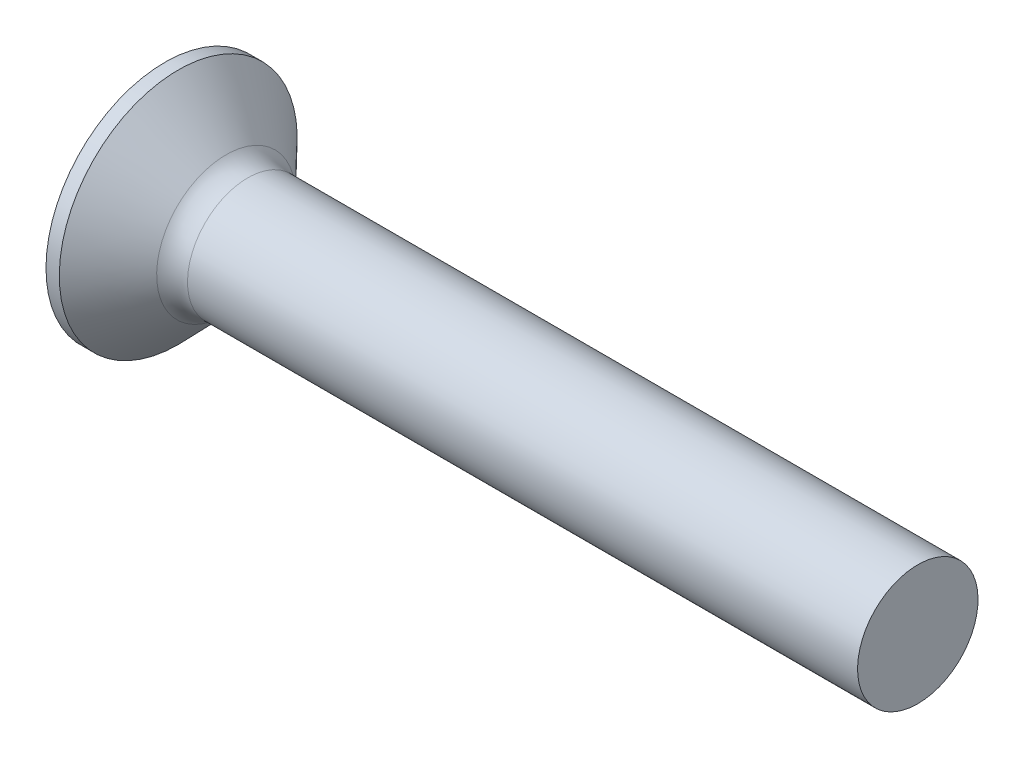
SolidWorks part; units mm, degrees
ref_plane "Front Plane" through (0, 0, 0) normal (0, 0, 1) x (1, 0, 0)
ref_plane "Top Plane" through (0, 0, 0) normal (0, 1, 0) x (1, 0, 0)
ref_plane "Right Plane" through (0, 0, 0) normal (1, 0, 0) x (0, 0, -1)
sketch "BodySke" plane through (0, 0, 0) normal (0, 0, 1) x (1, 0, 0)
  line L0 (2.0141, 0) -> (111.3824, 0) construction
  line L1 (2.0141, 0) -> (2.0141, 7.9) construction
  line L2 (2.0141, 7.9) -> (2.898, 7.9)
  line L3 (2.898, 7.9) -> (6.6641, 4)
  line L4 (6.6641, 4) -> (52.0141, 4)
  line L5 (52.0141, 4) -> (52.0141, 0)
  line L6 (7.9141, 1.8551) -> (7.9141, -12.8628) construction
  line L7 (2.0141, 0) -> (52.0141, 0)
  line L8 (9.1641, 2.7551) -> (9.1641, -11.0269) construction
  line L9 (2.0141, -7.9) -> (2.898, -7.9) construction
  line L10 (2.898, -7.9) -> (6.6641, -4) construction
  line L11 (6.6641, -4) -> (52.0141, -4) construction
  line L12 (2.0141, 0) -> (-7.747, 0) construction
  line L13 (0, 0) -> (0, 16.1338) construction
  line L14 (2.0141, 0) -> (0, 0)
  arc A0 (0, 0) -> (2.0141, 7.9) centre (16.5, 0) cw
  point P10 (52.0141, 3.4455)
  dimension "Head_radius" = 16.5
  dimension "Diameter" = 8
  dimension "Head_dia" = 15.8
  dimension "Head_height" = 4.65
  dimension "Length" = 50
  dimension "Advance" = 1.25
  dimension "Thread_minor" = 6.891
  dimension "Head_ang" = 92
  dimension "Tread_runout" = 2.5
revolve "BaseBody" add sketch "BodySke" angle 360 about L0
fillet "Fillet1" radius 2 1 edges at (6.6641, -4, 0)
ref_plane "Plane1" through (5.18, 0, 0) normal (1, 0, 0) x (0, 0, -1)
sketch "RecSkeTop" plane through (0, 0, 0) normal (1, 0, 0) x (0, 0, -1)
  line L1 (-0.946, 4.3) -> (0.946, 4.3)
  line L2 (-0.946, 4.3) -> (-0.946, -4.3)
  line L3 (-0.946, -4.3) -> (0.946, -4.3)
  line L4 (0.946, 4.3) -> (0.946, -4.3)
  dimension "D1" = 4.3
  dimension "Cross_dia" = 8.6
  dimension "D2" = 1.892
  dimension "D3" = 0.946
sketch "RecSkeBot" plane through (5.18, 0, 0) normal (1, 0, 0) x (0, 0, -1)
  line L0 (-0.946, 4.3) -> (-0.946, -4.3) construction
  line L1 (-0.946, 1.7173) -> (0.946, 1.7173)
  line L2 (-0.946, 1.7173) -> (-0.946, -1.7173)
  line L3 (-0.946, -1.7173) -> (0.946, -1.7173)
  line L4 (0.946, 1.7173) -> (0.946, -1.7173)
  line L5 (0.946, 4.3) -> (0.946, -4.3) construction
  dimension "D1" = 3.4347
  dimension "D2" = 1.7173
loft "Recess" cut profiles "RecSkeTop", "RecSkeBot"
pattern_circular "RecPat" count 2 every 90 about axis through (0, 0, 0) along (1, 0, 0) of "Recess"
sketch "RecCorSke" plane through (0, 0, 0) normal (0, 0, 1) x (1, 0, 0)
  line L0 (0, 0) -> (57.5987, 0) construction
  line L1 (0, 0) -> (0, 2.0812)
  line L3 (0, 2.0812) -> (5.18, 1.719)
  line L4 (5.18, 1.719) -> (5.7385, 0)
  line L5 (5.7385, 0) -> (0, 0)
  dimension "D1" = 18
  dimension "D2" = 5.18
  dimension "D3" = 2.0812
  dimension "D4" = 4
revolve "RecessCore" cut sketch "RecCorSke" angle 360 about L0
sketch "ThdSchSke" plane through (0, 0, 0) normal (0, 0, 1) x (1, 0, 0)
  line L0 (0, 0) -> (55.1256, 0) construction
  line L1 (2.0141, 0) -> (111.3824, 0) construction
  line L2 (51.694, 4) -> (51.694, 4.6403)
  line L3 (51.694, 4.6403) -> (52.3343, 4.6403)
  line L4 (52.3343, 4.6403) -> (52.3343, 4)
  line L5 (52.3343, 4) -> (52.0141, 3.4455)
  line L6 (52.0141, 3.4455) -> (51.694, 4)
  line L7 (6.6641, 4) -> (52.0141, 4) construction
  line L13 (52.0141, 4) -> (52.0141, 0) construction
revolve "ThreadSchematic" [suppressed] cut sketch "ThdSchSke" angle 360 about L0
pattern_linear "ThdSchPat" [suppressed] count 35 along (1, 0, 0)
equation "\"Thread_minor@ThreadCosmetic\" = \"Thread_minor@BodySke\""
equation "\"D1@RecSkeTop\" = \"Cross_dia@RecSkeTop\" / 2"
equation "\"D2@RecSkeTop\" = \"Cross_dia@RecSkeTop\" * 0.22"
equation "\"D3@RecSkeTop\" = \"D2@RecSkeTop\" / 2"
equation "\"D1@RecSkeBot\" = \"Cross_dia@RecSkeTop\" - 2 * \"Cross_depth@Plane1\" *  tan( 26.5 * 0.017453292 ) "
equation "\"D2@RecSkeBot\" = \"D1@RecSkeBot\" / 2"
equation "\"D2@RecCorSke\" = \"Cross_depth@Plane1\""
equation "\"D3@RecCorSke\" = \"D2@RecSkeTop\" * 1.1"
equation "\"Advance@ThdSchPat\" = \"Advance@BodySke\""
equation "\"D1@ThdSchPat\" =  int(  ( \"Length@BodySke\"-\"Head_height@BodySke\"-\"Tread_runout@BodySke\" )  / \"Advance@ThdSchPat\" )  + 1"
